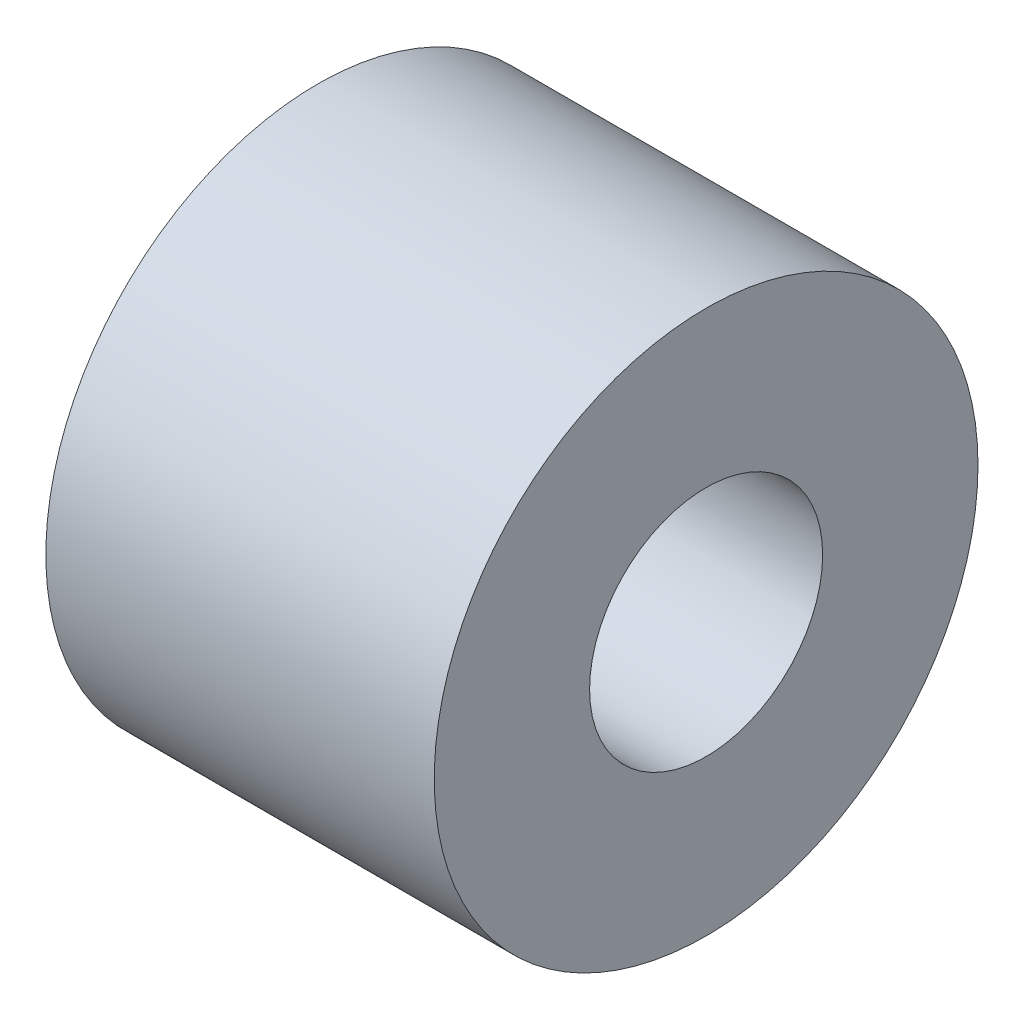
SolidWorks part; units mm, degrees
ref_plane "Front Plane" through (0, 0, 0) normal (0, 0, 1) x (1, 0, 0)
ref_plane "Top Plane" through (0, 0, 0) normal (0, 1, 0) x (1, 0, 0)
ref_plane "Right Plane" through (0, 0, 0) normal (1, 0, 0) x (0, 0, -1)
sketch "Sketch1" plane through (0, 0, 0) normal (1, 0, 0) x (0, 0, -1)
  circle A0 centre (0, 0) radius 3.5
  dimension "D1" = 7
extrude "Boss-Extrude1" add sketch "Sketch1" along normal blind 5
sketch "Sketch2" plane through (5, 0, 0) normal (1, 0, 0) x (0, 0, -1)
  circle A0 centre (0, 0) radius 1.5
  dimension "D1" = 3
extrude "Cut-Extrude1" cut sketch "Sketch2" against normal blind 4 contours A0
